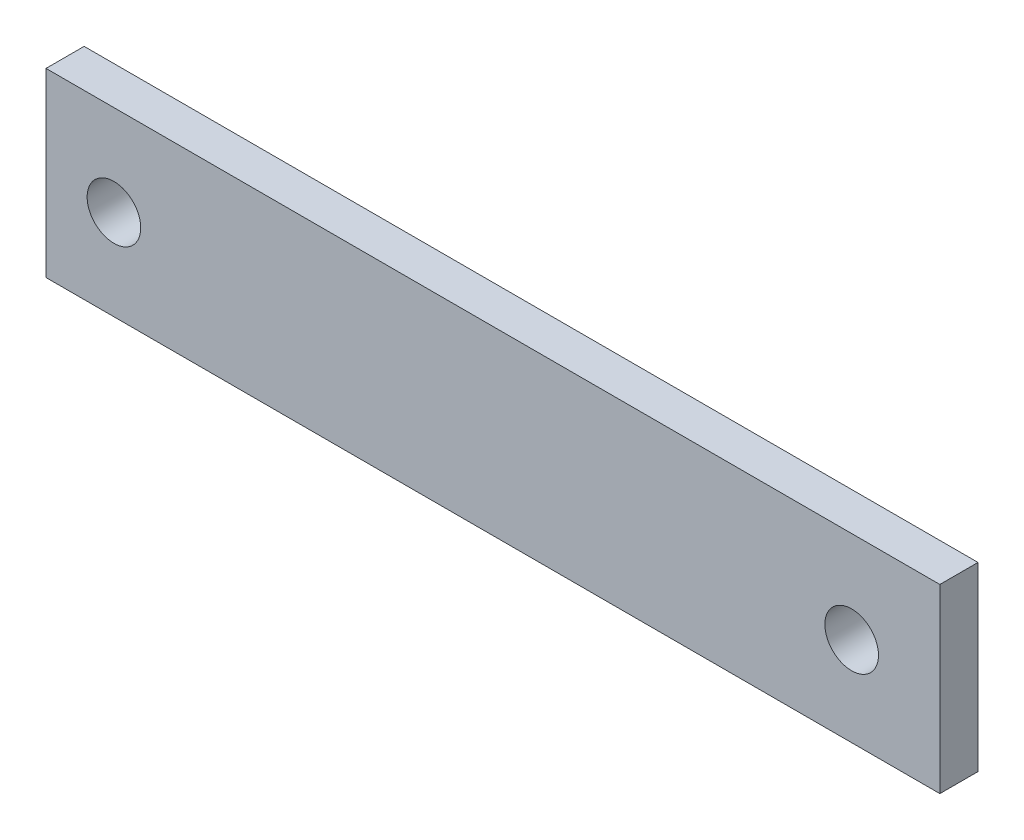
SolidWorks part; units mm, degrees
ref_plane "Plan de face" through (0, 0, 0) normal (0, 0, 1) x (1, 0, 0)
ref_plane "Plan de dessus" through (0, 0, 0) normal (0, 1, 0) x (1, 0, 0)
ref_plane "Plan de droite" through (0, 0, 0) normal (1, 0, 0) x (0, 0, -1)
sketch "Esquisse2" plane through (0, 0, 0) normal (0, 0, 1) x (1, 0, 0)
  line L0 (-20.6933, 15.2793) -> (9.4067, 15.2246) construction
  line L1 (-24.3933, 19.086) -> (13.1067, 19.086)
  line L2 (-24.3933, 19.086) -> (-24.3933, 11.486)
  line L3 (-24.3933, 11.486) -> (13.1067, 11.486)
  line L4 (13.1067, 19.086) -> (13.1067, 11.486)
  line L5 (-5.6433, 15.2519) -> (-5.6433, 30.069) construction
  line L6 (9.4067, 15.2246) -> (39.5033, 15.2246) construction
  circle A0 centre (-21.5433, 15.2793) radius 0.85 construction
  circle A1 centre (9.4067, 15.2246) radius 1.1249 construction
  circle A2 centre (-21.5433, 15.2793) radius 1.1249 construction
  circle A3 centre (9.4067, 15.2246) radius 1.1249
  circle A4 centre (-21.5433, 15.2793) radius 1.1249
  point P10 (-5.6433, 19.086)
  point P13 (-24.3933, 15.286)
  dimension "D1" = 37.5
  dimension "D2" = 7.6
extrude "Extrusion1" add sketch "Esquisse2" along normal blind 1.6
